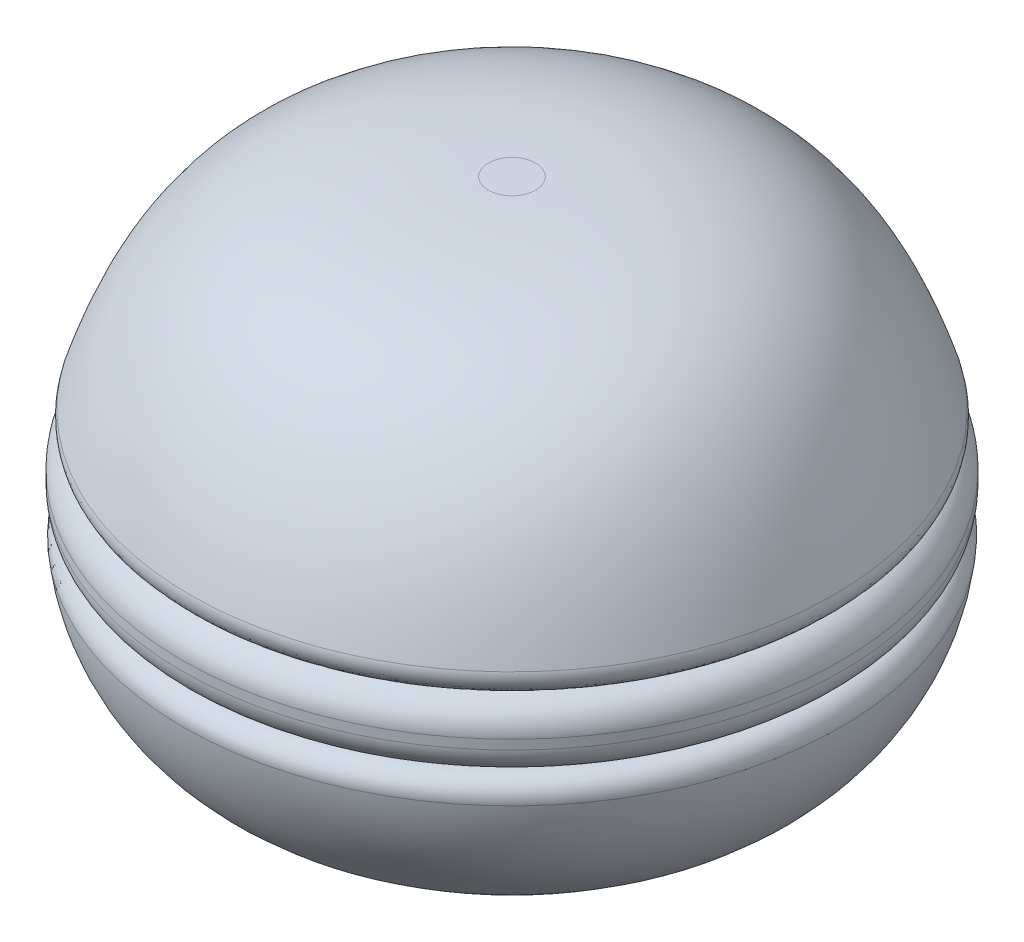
SolidWorks part; units mm, degrees
ref_plane "Front Plane" through (0, 0, 0) normal (0, 0, 1) x (1, 0, 0)
ref_plane "Top Plane" through (0, 0, 0) normal (0, 1, 0) x (1, 0, 0)
ref_plane "Right Plane" through (0, 0, 0) normal (1, 0, 0) x (0, 0, -1)
sketch "Sketch2" plane through (0, 0, 0) normal (0, 1, 0) x (1, 0, 0)
  circle A0 centre (0, 0) radius 17.5
extrude "Boss-Extrude2" add sketch "Sketch2" along normal blind 12
fillet "Fillet1" radius 17 1 edges at (0, 12, 17.5)
fillet "Fillet2" radius 1 1 edges
sketch "Sketch3" plane through (0, 0, 0) normal (0, -1, 0) x (1, 0, 0)
  circle A1 centre (0, 0) radius 17.5
extrude "Boss-Extrude3" add sketch "Sketch3" along normal blind 3.5 separate body
fillet "Fillet3" radius 1.5 2 edges at (0, 0, -17.5) (0, -3.5, -17.5)
sketch "Sketch4" plane through (0, -3.5, 0) normal (0, -1, 0) x (1, 0, 0)
  circle A0 centre (0, 0) radius 17.5
extrude "Boss-Extrude4" add sketch "Sketch4" along normal blind 10 separate body
fillet "Fillet4" radius 10 1 edges at (0, -13.5, -17.5)
fillet "Fillet5" radius 1 1 edges at (0, -3.5, -17.5)
